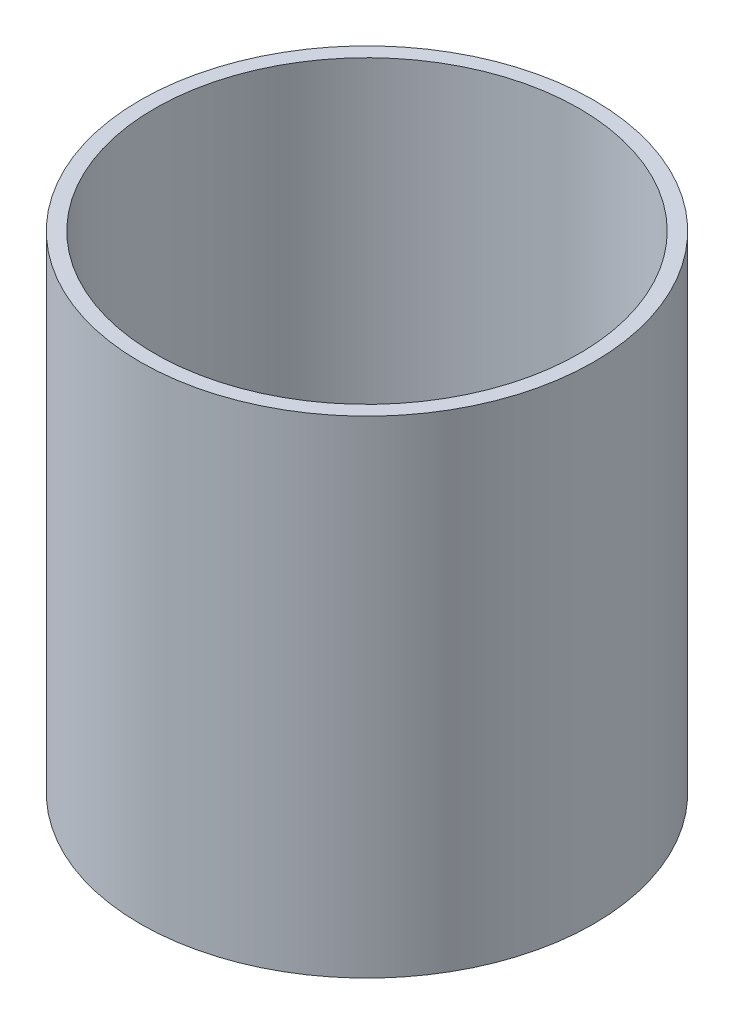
SolidWorks part; units mm, degrees
ref_plane "Front Plane" through (0, 0, 0) normal (0, 0, 1) x (1, 0, 0)
ref_plane "Top Plane" through (0, 0, 0) normal (0, 1, 0) x (1, 0, 0)
ref_plane "Right Plane" through (0, 0, 0) normal (1, 0, 0) x (0, 0, -1)
sketch "Sketch1" plane through (0, 0, 0) normal (0, 1, 0) x (1, 0, 0)
  circle A0 centre (0, 0) radius 20.8915
  dimension "D1" = 41.783
extrude "Extrude1" add sketch "Sketch1" along normal blind 44.831
sketch "Sketch2" plane through (0, 0, 0) normal (0, -1, 0) x (1, 0, 0)
  circle A0 centre (0, 0) radius 19.558
  dimension "D1" = 39.116
extrude "Cut-Extrude1" cut sketch "Sketch2" against normal through all
